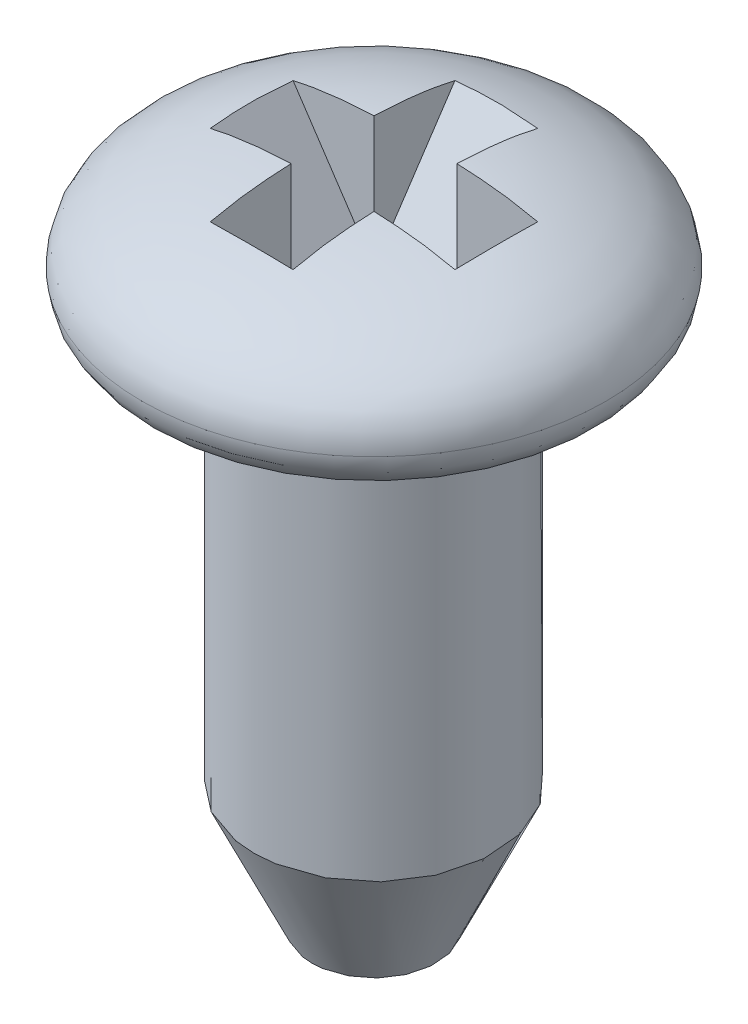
SolidWorks part; units mm, degrees
ref_plane "Plan de face" through (0, 0, 0) normal (0, 0, 1) x (1, 0, 0)
ref_plane "Plan de dessus" through (0, 0, 0) normal (0, 1, 0) x (1, 0, 0)
ref_plane "Plan de droite" through (0, 0, 0) normal (1, 0, 0) x (0, 0, -1)
sketch "Esquisse1" plane through (0, 0, 0) normal (0, 1, 0) x (1, 0, 0)
  circle A0 centre (0, 0) radius 1.45
extrude "Extrusion1" add sketch "Esquisse1" along normal blind 6.4
sketch "Esquisse2" plane through (0, 0, 0) normal (0, 0, 1) x (1, 0, 0)
  line L0 (-3.5764, 6.4) -> (3.9855, 6.4) construction
  line L1 (0, 8.9067) -> (0, 4.7448) construction
  line L2 (-2.6992, 8) -> (4.0303, 8) construction
  line L3 (-2.8, 8.6386) -> (-2.8, 5.3938) construction
  line L4 (0, 6.4) -> (-2.3, 6.4)
  line L5 (0, 8) -> (0, 6.4)
  arc A0 (-2.3, 6.4) -> (-2.8, 6.9001) centre (-2.3, 6.9) cw
  spline S0 degree 3 poles (-2.8, 6.9001) (-2.802, 7.3106) (-1.7042, 7.9956) (-0.6729, 7.9983) (0, 8) knots 0 0 0 0 0.347597 1 1 1 1
  point P15 (-2.8, 6.4)
  point P18 (-2.8, 8)
  point P21 (0, 6.4)
  dimension "D1" = 0.5
revolve "Révolution1" add sketch "Esquisse2" angle 360 about L1
sketch "Esquisse3" plane through (0, 0, 0) normal (0, 0, 1) x (1, 0, 0)
  line L0 (0, 9.9885) -> (0, 5.1977) construction
  line L1 (-3.3122, 6.4) -> (4.0377, 6.4) construction
  line L2 (-3.6691, 0) -> (6.2564, 0) construction
  line L3 (-1.5, 8.9361) -> (-1.5, 5.7428) construction
  line L4 (-0.5, 7.218) -> (-0.5, 5.7428) construction
  line L5 (0, 8.589) -> (-1.5, 8.3981)
  line L6 (-2.5295, 7.9) -> (1.4809, 7.9) construction
  line L7 (-1.5, 8.3981) -> (-1.5, 7.9)
  line L8 (-1.5, 7.9) -> (-0.5, 6.4)
  line L9 (-0.5, 6.4) -> (0.5, 6.4)
  line L10 (1.5, 7.9) -> (0.5, 6.4)
  line L11 (1.5, 8.3981) -> (1.5, 7.9)
  line L12 (0, 8.589) -> (1.5, 8.3981)
  point P19 (0, 6.4)
extrude "Enlèv. mat.-Extru.1" cut sketch "Esquisse3" against normal mid plane 1
pattern_circular "Répétition circulaire1" count 2 every 90 about axis through (0, 0, 0) along (0, 1, 0) of "Enlèv. mat.-Extru.1"
chamfer "Chanfrein1" distance 0.7 distance2 1.5 1 edges at (0, 0, 1.45)
